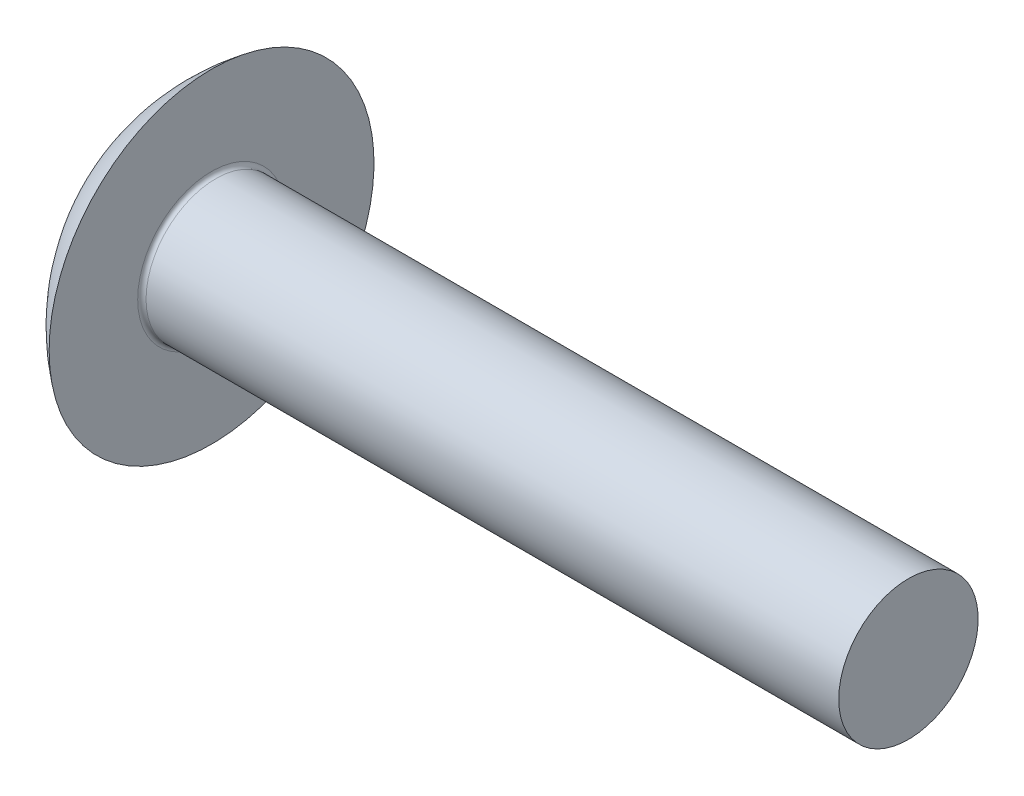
SolidWorks part; units mm, degrees
ref_plane "Front" through (0, 0, 0) normal (0, 0, 1) x (1, 0, 0)
ref_plane "Top" through (0, 0, 0) normal (0, 1, 0) x (1, 0, 0)
ref_plane "Right" through (0, 0, 0) normal (1, 0, 0) x (0, 0, -1)
other "Configuration Table"
sketch "Sketch1" plane through (0, 0, 0) normal (0, 0, 1) x (1, 0, 0)
  line L0 (-81.1665, 0) -> (18.3405, 0) construction
  line L1 (55.8733, 0) -> (55.8733, 5)
  line L2 (55.8733, 5) -> (5.8733, 5)
  line L3 (5.8733, 5) -> (5.8733, 11.6547)
  line L4 (55.8733, 0) -> (0, 0)
  arc A0 (5.8733, 11.6547) -> (0, 0) centre (14.5, 0) ccw
  dimension "R" = 14.5
  dimension "d" = 10
  dimension "l" = 50
  dimension "K" = 5.8733
revolve "Base-Revolve" add sketch "Sketch1" angle 360 about L0
fillet "Fillet1" radius 0.3 1 edges at (5.8733, 0, 5)
